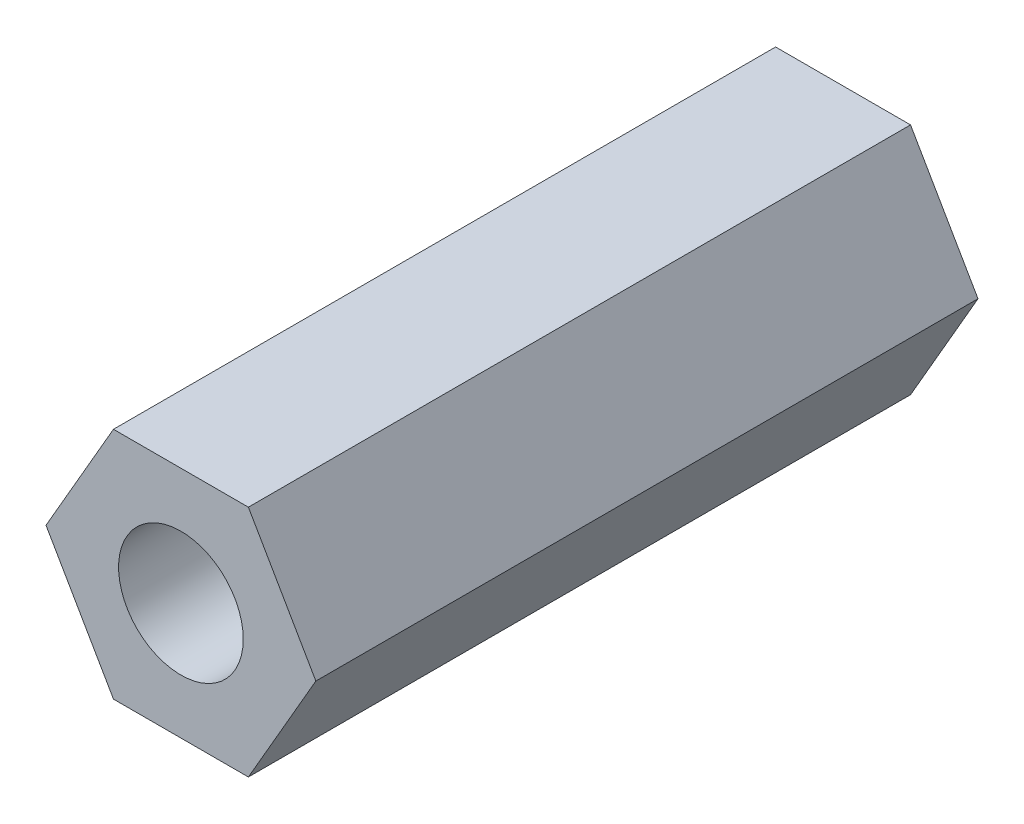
SolidWorks part; units mm, degrees
ref_plane "Спереди" through (0, 0, 0) normal (0, 0, 1) x (1, 0, 0)
ref_plane "Сверху" through (0, 0, 0) normal (0, 1, 0) x (1, 0, 0)
ref_plane "Справа" through (0, 0, 0) normal (1, 0, 0) x (0, 0, -1)
sketch "Эскиз1" plane through (0, 0, 0) normal (0, 0, 1) x (1, 0, 0)
  line L0 (-10, 10) -> (10, 10) construction
  line L1 (1.7321, 3) -> (-1.7321, 3)
  line L2 (-1.7321, 3) -> (-3.4641, 0)
  line L3 (-3.4641, 0) -> (-1.7321, -3)
  line L4 (-1.7321, -3) -> (1.7321, -3)
  line L5 (1.7321, -3) -> (3.4641, 0)
  line L6 (3.4641, 0) -> (1.7321, 3)
  circle A0 centre (0, 0) radius 3 construction
  circle A1 centre (0, 0) radius 1.6
  point P11 (0, 10)
  dimension "D4" = 3.2
  dimension "D1" = 10
  dimension "D2" = 20
  dimension "D3" = 6
extrude "Бобышка-Вытянуть1" add sketch "Эскиз1" along normal blind 17
